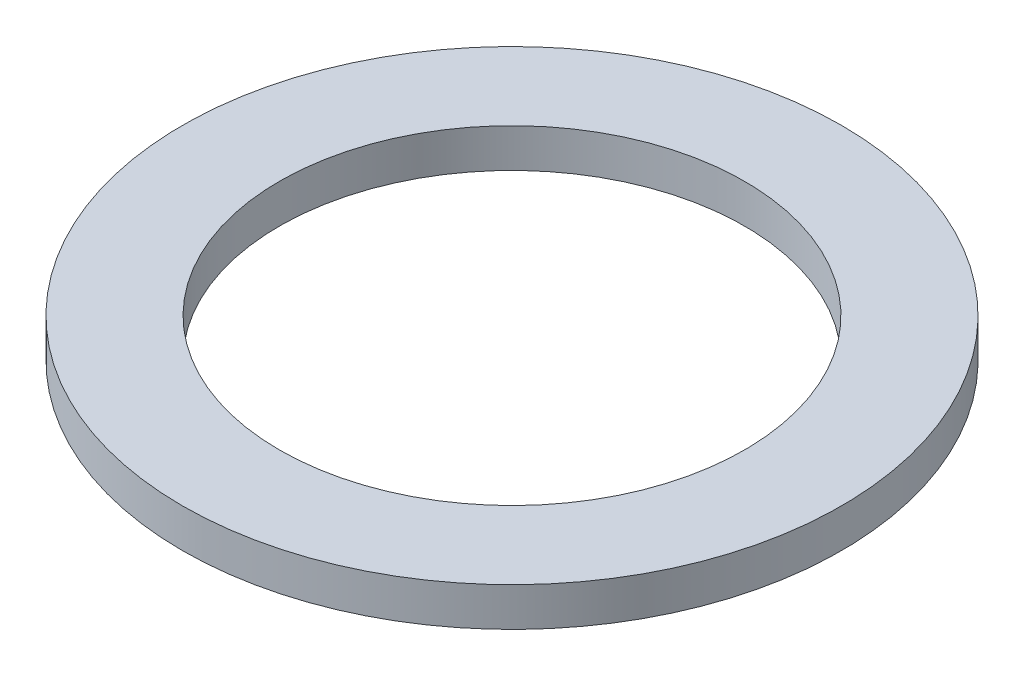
SolidWorks part; units mm, degrees
ref_plane "Plan1" through (0, 0, 0) normal (0, 0, 1) x (1, 0, 0)
ref_plane "Plan2" through (0, 0, 0) normal (0, 1, 0) x (1, 0, 0)
ref_plane "Plan3" through (0, 0, 0) normal (1, 0, 0) x (0, 0, -1)
sketch "Esquisse1" plane through (0, 0, 0) normal (0, 1, 0) x (1, 0, 0)
  circle A0 centre (0, 0) radius 4.25
  circle A1 centre (0, 0) radius 3
  dimension "D1" = 8.5
  dimension "D2" = 6
extrude "Base-Extrusion" add sketch "Esquisse1" along normal blind 0.5
